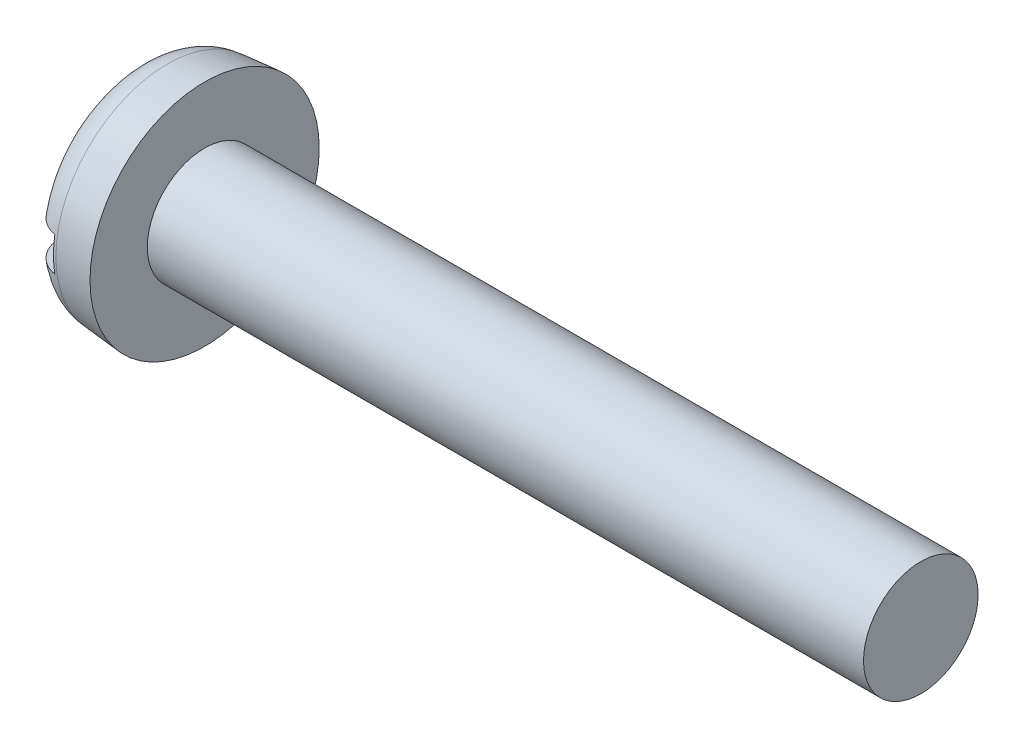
SolidWorks part; units mm, degrees
ref_plane "Plane1" through (0, 0, 0) normal (0, 0, 1) x (1, 0, 0)
ref_plane "Plane2" through (0, 0, 0) normal (0, 1, 0) x (1, 0, 0)
ref_plane "Plane3" through (0, 0, 0) normal (1, 0, 0) x (0, 0, -1)
sketch "BodySke" plane through (0, 0, 0) normal (0, 0, 1) x (1, 0, 0)
  line L0 (2.4, 2) -> (2.4, 4)
  line L1 (0, 0) -> (0, 3.79)
  line L2 (-25.4, 0) -> (127, 0) construction
  line L3 (27.4, 0) -> (0, 0)
  line L4 (2.4, 2) -> (27.4, 2)
  line L5 (27.4, 2) -> (27.4, 0)
  line L6 (0, 3.79) -> (2.4, 4)
  line L9 (3.1, 3.5875) -> (3.1, -5.9375) construction
  line L10 (2.4, 6.35) -> (2.4, -3.175) construction
  dimension "Head_ht" = 2.4
  dimension "Diameter" = 4
  dimension "Length" = 25
  dimension "Head_dia" = 8
  dimension "Advance" = 0.7
  dimension "Thread_nom" = 25
  dimension "Head_side_angle" = 5
revolve "Base-Revolve" add sketch "BodySke"
fillet "Fillet1" [suppressed] radius 0.2
fillet "Fillet2" radius 1.2 1 edges at (0, 0, 3.79)
sketch "Sketch2" plane through (0, 0, 0) normal (1, 0, 0) x (0, 0, -1)
  line L0 (4, -0.6) -> (-4, -0.6)
  line L1 (4, -0.6) -> (4, 0.6)
  line L2 (-4, 0.6) -> (4, 0.6)
  line L3 (-4, 0.6) -> (-4, -0.6)
  dimension "D1" = 8
  dimension "D2" = 4
  dimension "Slot_width" = 1.2
  dimension "D3" = 0.6
extrude "Slot" cut sketch "Sketch2" along normal blind 1
sketch "ThdSchSke" plane through (0, 0, 0) normal (0, 0, 1) x (1, 0, 0)
  line L0 (3.8, -1.61) -> (3.5269, -2)
  line L1 (3.8, -1.61) -> (4.0731, -2)
  line L2 (4.0731, -2) -> (4.0731, -2.5)
  line L3 (-3.175, 0) -> (5.1513, 0) construction
  line L5 (4.0731, -2.5) -> (3.5269, -2.5)
  line L6 (3.5269, -2.5) -> (3.5269, -2)
  dimension "Thread_minor" = 3.22
  dimension "Diameter" = 4
  dimension "Start" = 3.8
  dimension "SideAngle" = 55
  dimension "VeeAngle" = 70
  dimension "Overcut" = 5
revolve "ThreadSchematic" [suppressed] cut sketch "ThdSchSke" angle 360 about L3
pattern_linear "ThdSchPat" [suppressed]
equation "\"D1@Sketch2\" = \"Head_dia@BodySke\""
equation "\"D2@Sketch2\" = \"D1@Sketch2\" / 2"
equation "\"D3@Sketch2\" = \"Slot_width@Sketch2\" / 2"
equation "\"Thread_length@ThreadCosmetic\" = ((sgn( (\"Length@BodySke\" - \"Advance@BodySke\" * 2.0 ) - \"Thread_nom@BodySke\" )-1)*( (\"Length@BodySke\" - \"Advance@BodySke\"  * 2.0) - \"Thread_nom@BodySke\" ))/-2+ \"Thread_"
equation "\"Thread_minor@ThdSchSke\" = \"Thread_minor@ThreadCosmetic\""
equation "\"Diameter@ThdSchSke\" = \"Diameter@BodySke\""
equation "\"Overcut@ThdSchSke\" = \"Diameter@BodySke\" * 1.25"
equation "\"Start@ThdSchSke\" = \"Head_ht@BodySke\" + \"Length@BodySke\" - \"Thread_length@ThreadCosmetic\"  '---Non-countersunk---"
equation "\"Num_threads@ThdSchPat\" = int( \"Thread_length@ThreadCosmetic\" / \"Advance@BodySke\" + 0.999 )  + 1"
equation "\"Advance@ThdSchPat\" = \"Thread_length@ThreadCosmetic\" /  (\"Num_threads@ThdSchPat\" - 1) 'relax it"
